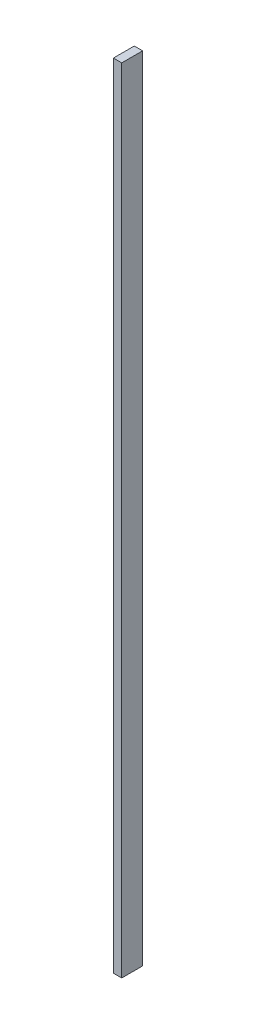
SolidWorks part; units mm, degrees
ref_plane "Plan de face" through (0, 0, 0) normal (0, 0, 1) x (1, 0, 0)
ref_plane "Plan de dessus" through (0, 0, 0) normal (0, 1, 0) x (1, 0, 0)
ref_plane "Plan de droite" through (0, 0, 0) normal (1, 0, 0) x (0, 0, -1)
sketch "Esquisse1" plane through (0, 0, 0) normal (0, 1, 0) x (1, 0, 0)
  line L1 (0, 0) -> (20, 0)
  line L2 (0, 0) -> (0, 50)
  line L3 (0, 50) -> (20, 50)
  line L4 (20, 0) -> (20, 50)
  dimension "D1" = 20
  dimension "D2" = 50
extrude "Extrusion1" add sketch "Esquisse1" along normal blind 1900
